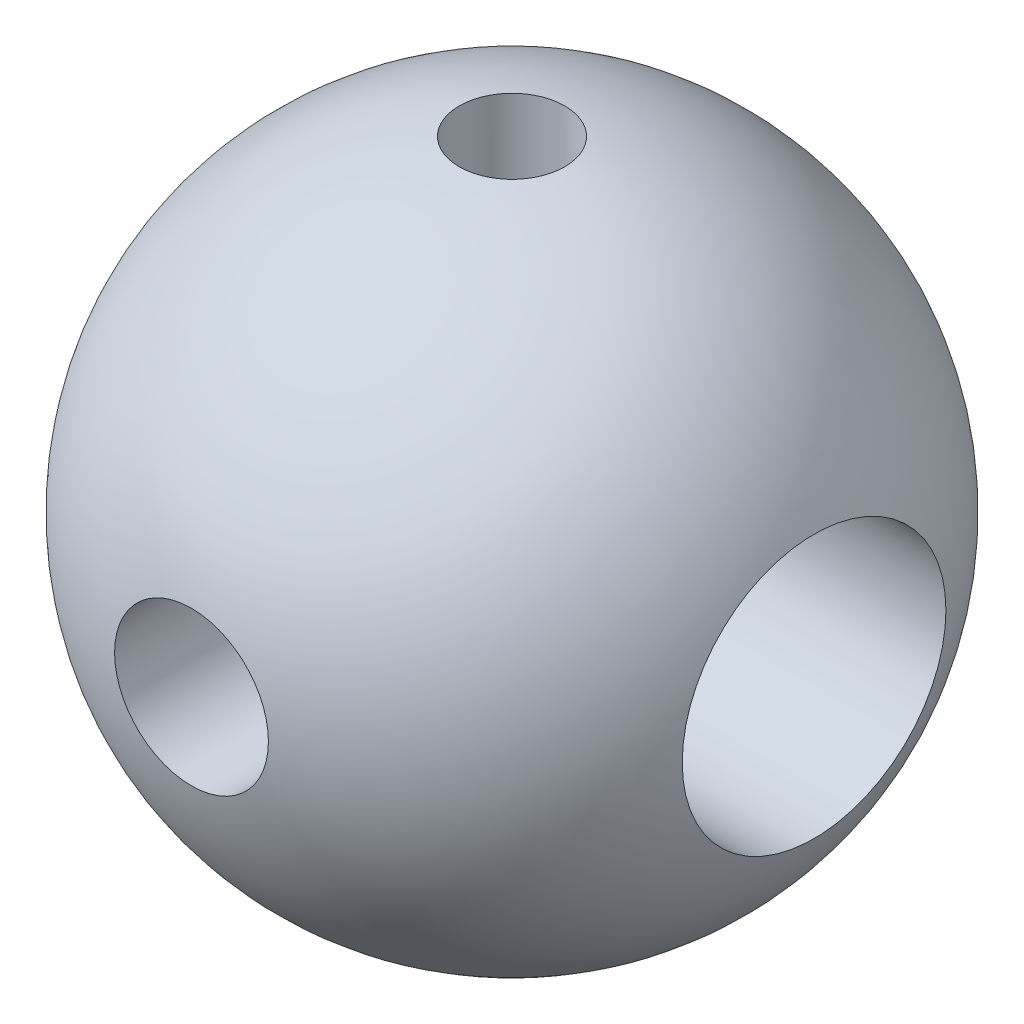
SolidWorks part; units mm, degrees
ref_plane "Plan de face" through (0, 0, 0) normal (0, 0, 1) x (1, 0, 0)
ref_plane "Plan de dessus" through (0, 0, 0) normal (0, 1, 0) x (1, 0, 0)
ref_plane "Plan de droite" through (0, 0, 0) normal (1, 0, 0) x (0, 0, -1)
sketch "Esquisse1" plane through (0, 0, 0) normal (0, 0, 1) x (1, 0, 0)
  line L0 (0, 75) -> (0, -75)
  arc A0 (0, 75) -> (0, -75) centre (0, 0) ccw
  dimension "D1" = 150
revolve "Révolution1" add sketch "Esquisse1" angle 360 about L0
sketch "Esquisse2" plane through (0, 0, 0) normal (0, 1, 0) x (1, 0, 0)
  circle A0 centre (0, 0) radius 12
  dimension "D1" = 24
extrude "Enlèv. mat.-Extru.1" cut sketch "Esquisse2" against normal through all and the other way through all
sketch "Esquisse3" plane through (0, 0, 0) normal (0, 0, 1) x (1, 0, 0)
  circle A0 centre (0, 0) radius 17.5
  dimension "D1" = 35
extrude "Enlèv. mat.-Extru.2" cut sketch "Esquisse3" against normal through all and the other way through all
sketch "Esquisse4" plane through (0, 0, 0) normal (1, 0, 0) x (0, 0, -1)
  circle A0 centre (0, 0) radius 30
  dimension "D1" = 60
extrude "Enlèv. mat.-Extru.3" cut sketch "Esquisse4" against normal through all and the other way through all
